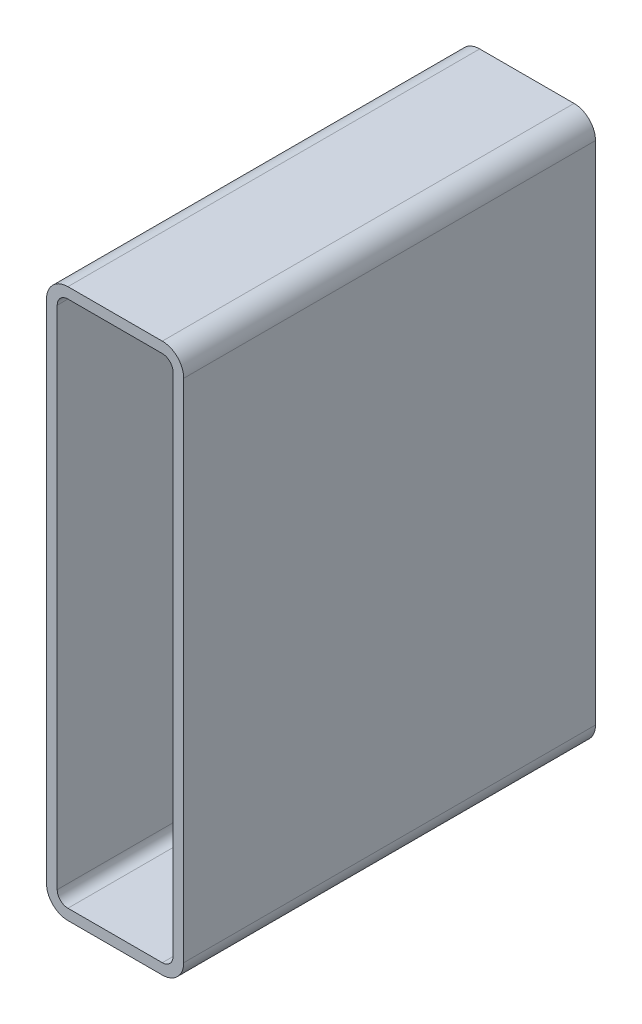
SolidWorks part; units mm, degrees
ref_plane "Front Plane" through (0, 0, 0) normal (0, 0, 1) x (1, 0, 0)
ref_plane "Top Plane" through (0, 0, 0) normal (0, 1, 0) x (1, 0, 0)
ref_plane "Right Plane" through (0, 0, 0) normal (1, 0, 0) x (0, 0, -1)
sketch "Sketch1" plane through (0, 0, 0) normal (0, 0, 1) x (1, 0, 0)
sketch_block_instance "HSS16x4x0.3125-1"
sketch_block "HSS16x4x0.3125"
extrude "Boss-Extrude1" add sketch "Sketch1" along normal blind 304.8
